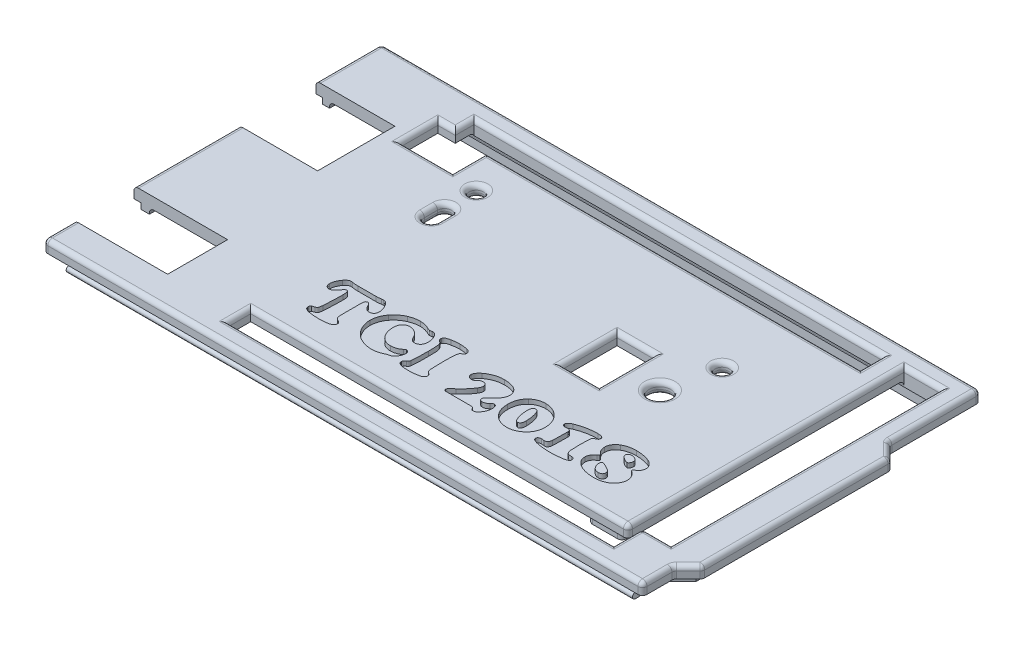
SolidWorks part; units mm, degrees
ref_plane "Front Plane" through (0, 0, 0) normal (0, 0, 1) x (1, 0, 0)
ref_plane "Top Plane" through (0, 0, 0) normal (0, 1, 0) x (1, 0, 0)
ref_plane "Right Plane" through (0, 0, 0) normal (1, 0, 0) x (0, 0, -1)
sketch "Sketch1" plane through (0, 0, 0) normal (0, 1, 0) x (1, 0, 0)
  line L0 (-61.422, -13.8418) -> (43.538, -13.8418)
  line L4 (46.078, -65.0518) -> (43.538, -67.5918)
  line L5 (43.538, -67.5918) -> (43.538, -73.0818)
  line L6 (43.538, -73.0818) -> (-61.422, -73.0818)
  line L7 (-61.422, -73.0818) -> (-61.422, -13.8418)
  line L8 (43.538, -13.8418) -> (43.538, -29.7418)
  line L9 (43.538, -29.7418) -> (46.078, -32.2818)
  line L10 (46.078, -32.2818) -> (46.078, -65.0518)
extrude "Boss-Extrude1" add sketch "Sketch1" along normal blind 2
sketch "Sketch2" plane through (0, 2, 0) normal (0, 1, 0) x (1, 0, 0)
  line L0 (-61.422, -13.8418) -> (-61.422, -73.0818) construction
  line L1 (-61.422, -67.7018) -> (-45.022, -67.7018)
  line L2 (-61.422, -67.7018) -> (-61.422, -57.2018)
  line L3 (-61.422, -57.2018) -> (-45.022, -57.2018)
  line L4 (-45.022, -67.7018) -> (-45.022, -57.2018)
  line L5 (-61.422, -73.0818) -> (43.538, -73.0818) construction
  line L6 (-61.422, -25.3418) -> (-47.572, -25.3418)
  line L7 (-61.422, -25.3418) -> (-61.422, -38.8818)
  line L8 (-61.422, -38.8818) -> (-47.572, -38.8818)
  line L9 (-47.572, -25.3418) -> (-47.572, -38.8818)
  line L10 (43.538, -13.8418) -> (-61.422, -13.8418) construction
  line L11 (43.538, -29.7418) -> (43.538, -13.8418) construction
  line L12 (-32.552, -65.6318) -> (33.548, -65.6318)
  line L13 (-32.552, -65.6318) -> (-32.552, -69.5418)
  line L14 (-32.552, -69.5418) -> (34.988, -69.5418)
  line L15 (34.988, -65.6318) -> (34.988, -69.5418)
  line L16 (39.998, -64.5318) -> (34.988, -64.5318)
  line L17 (39.998, -64.5318) -> (39.998, -17.3118)
  line L18 (39.998, -17.3118) -> (33.548, -17.3118)
  line L19 (33.548, -64.5318) -> (33.548, -17.3118)
  line L20 (-31.902, -33.5618) -> (-31.902, -35.8518)
  line L21 (-41.692, -17.3818) -> (29.908, -17.3818)
  line L22 (-41.692, -17.3818) -> (-41.692, -20.6518)
  line L23 (-35.622, -21.2918) -> (29.908, -21.2918)
  line L24 (29.908, -17.3818) -> (29.908, -21.2918)
  line L25 (-44.742, -20.6518) -> (-41.692, -20.6518)
  line L26 (-44.742, -20.6518) -> (-44.742, -27.1518)
  line L27 (-44.742, -27.1518) -> (-35.622, -27.1518)
  line L28 (-35.622, -21.2918) -> (-35.622, -27.1518)
  line L29 (-29.452, -33.5618) -> (-29.452, -35.8518)
  line L30 (46.078, -65.0518) -> (46.078, -32.2818) construction
  line L31 (3.188, -37.1818) -> (9.688, -37.1818)
  line L32 (3.188, -37.1818) -> (3.188, -46.8018)
  line L33 (3.188, -46.8018) -> (9.688, -46.8018)
  line L34 (9.688, -37.1818) -> (9.688, -46.8018)
  line L35 (34.988, -65.6318) -> (34.988, -64.5318)
  line L36 (33.548, -64.5318) -> (33.548, -65.6318)
  circle A0 centre (-30.677, -27.9718) radius 1.225
  arc A1 (-29.452, -33.5618) -> (-31.902, -33.5618) centre (-30.677, -33.5618) ccw
  arc A2 (-31.902, -35.8518) -> (-29.452, -35.8518) centre (-30.677, -35.8518) ccw
  circle A3 centre (17.718, -33.3018) radius 1.225
  circle A4 centre (15.698, -42.1918) radius 1.875
  point P18 (-32.552, -67.5868)
  point P29 (29.908, -19.3368)
extrude "Cut-Extrude1" cut sketch "Sketch2" against normal blind 2
sketch "Sketch3" plane through (0, 0, 0) normal (0, -1, 0) x (1, 0, 0)
  line L0 (43.538, 13.8418) -> (-61.422, 13.8418) construction
  line L1 (-60.222, 15.0418) -> (42.338, 15.0418)
  line L2 (-60.222, 15.0418) -> (-60.222, 17.3818)
  line L3 (-59.022, 17.3118) -> (39.998, 17.3118)
  line L4 (42.338, 15.0418) -> (42.338, 18.3118)
  line L5 (43.538, 29.7418) -> (43.538, 13.8418) construction
  line L6 (-61.422, 13.8418) -> (-61.422, 25.3418) construction
  line L7 (-61.422, 38.8818) -> (-47.572, 38.8818) construction
  line L8 (-47.572, 25.3418) -> (-61.422, 25.3418) construction
  line L10 (-60.222, 17.3818) -> (-60.222, 25.3418)
  line L11 (-60.222, 25.3418) -> (-59.022, 25.3418)
  line L12 (-59.022, 17.3118) -> (-59.022, 25.3418)
  line L13 (-61.422, 73.0818) -> (43.538, 73.0818) construction
  line L14 (-60.222, 71.8818) -> (40.588, 71.8818)
  line L15 (-60.222, 71.8818) -> (-60.222, 69.5418)
  line L16 (-59.022, 69.5418) -> (40.1778, 69.5418)
  line L18 (-32.552, 69.5418) -> (34.988, 69.5418) construction
  line L19 (-61.422, 67.7018) -> (-61.422, 73.0818) construction
  line L20 (-58.7131, 38.8818) -> (-60.222, 38.8818)
  line L21 (-61.422, 67.7018) -> (-45.022, 67.7018) construction
  line L23 (-60.222, 69.5418) -> (-60.222, 67.7018)
  line L24 (-60.222, 67.7018) -> (-59.022, 67.7018)
  line L25 (-59.022, 69.5418) -> (-59.022, 67.7018)
  line L26 (39.998, 17.3118) -> (33.548, 17.3118) construction
  line L32 (-58.7131, 38.8818) -> (-58.7131, 57.2018)
  line L33 (-58.7131, 57.2018) -> (-60.222, 57.2018)
  line L34 (-60.222, 38.8818) -> (-60.222, 57.2018)
  line L35 (-45.022, 57.2018) -> (-61.422, 57.2018) construction
  line L37 (39.998, 17.3118) -> (39.998, 29.7418)
  line L39 (42.338, 18.3118) -> (42.338, 29.7418)
  line L43 (46.078, 65.0518) -> (46.078, 32.2818) construction
  line L45 (44.878, 32.2818) -> (44.878, 65.0518)
  line L47 (42.7178, 32.2818) -> (42.7178, 65.0518)
  line L50 (42.338, 29.7418) -> (44.878, 32.2818)
  line L52 (42.7178, 32.2818) -> (39.998, 29.7418)
  line L53 (40.588, 71.8818) -> (42.338, 71.8818)
  line L56 (42.338, 71.8818) -> (42.338, 67.5918)
  line L57 (43.538, 73.0818) -> (43.538, 67.5918) construction
  line L58 (44.878, 65.0518) -> (42.338, 67.5918)
  line L59 (42.7178, 65.0518) -> (40.1778, 67.5918)
  line L60 (40.1778, 67.5918) -> (40.1778, 69.5418)
  line L61 (-61.422, 38.8818) -> (-61.422, 57.2018) construction
  point P6 (42.338, 16.6768)
extrude "Boss-Extrude2" add sketch "Sketch3" along normal blind 1
fillet "Fillet31" radius 0.8 1 edges at (-61.422, 1, 73.0818)
fillet "Fillet33" radius 0.8 4 edges at (34.988, 2, 67.0368) (0.498, 2, 65.6318) (-32.552, 2, 67.5868) (1.218, 2, 69.5418)
fillet "Fillet35" radius 0.8 8 edges at (34.988, 0.6, 64.5318) (35.2223, 1.7657, 64.5318) (33.548, 0.6, 65.6318) (33.548, 1.7657, 65.3975) (36.773, 2, 17.3118) (39.998, 2, 40.9218) (37.893, 2, 64.5318) (33.548, 2, 41.0718)
fillet "Fillet37" radius 0.8 8 edges at (-43.217, 2, 20.6518) (-40.182, 2, 27.1518) (-35.622, 2, 24.2218) (-41.692, 2, 19.0168) (29.908, 2, 19.3368) (-5.892, 2, 17.3818) (-2.857, 2, 21.2918) (-44.742, 2, 23.9018)
fillet "Fillet38" radius 0.8 4 edges at (-30.677, 2, 32.3368) (-31.902, 2, 34.7068) (-30.677, 2, 37.0768) (-29.452, 2, 34.7068)
fillet "Fillet39" radius 0.8 1 edges at (-30.677, 2, 29.1968)
fillet "Fillet40" radius 0.8 6 edges at (6.438, 2, 37.1818) (3.188, 2, 41.9918) (9.688, 2, 41.9918) (6.438, 2, 46.8018) (15.698, 2, 44.0668) (17.718, 2, 34.5268)
sketch "Sketch6" plane through (0, 0, 0) normal (0, -1, 0) x (1, 0, 0)
  line L0 (46.078, 65.0518) -> (46.078, 32.2818) construction
  line L1 (21.048, 60.1318) -> (26.998, 60.1318)
  line L2 (21.048, 60.1318) -> (21.048, 56.2518)
  line L3 (21.048, 56.2518) -> (26.998, 56.2518)
  line L4 (26.998, 60.1318) -> (26.998, 56.2518)
  line L5 (-60.622, 73.0818) -> (43.538, 73.0818) construction
  line L6 (-61.422, 38.8818) -> (-61.422, 57.2018) construction
  line L7 (-20.332, 46.7518) -> (-26.282, 46.7518)
  line L8 (-20.332, 46.7518) -> (-20.332, 42.8718)
  line L9 (-20.332, 42.8718) -> (-26.282, 42.8718)
  line L10 (-26.282, 46.7518) -> (-26.282, 42.8718)
  point P12 (-26.282, 44.8118)
  point P15 (-20.332, 44.8118)
extrude "Boss-Extrude5" add sketch "Sketch6" along normal blind 6.3
fillet "Fillet44" radius 0.8 8 edges at (24.023, 0, 60.1318) (26.998, 0, 58.1918) (24.023, 0, 56.2518) (21.048, 0, 58.1918) (-23.307, 0, 46.7518) (-26.282, 0, 44.8118) (-20.332, 0, 44.8118) (-23.307, 0, 42.8718)
fillet "Fillet45" radius 0.8 16 edges at (-20.0977, -0.2343, 42.6375) (-26.5163, -0.2343, 42.6375) (-26.5163, -0.2343, 46.9861) (-20.0977, -0.2343, 46.9861) (20.8137, -0.2343, 56.0175) (20.8137, -0.2343, 60.3661) (27.2323, -0.2343, 60.3661) (27.2323, -0.2343, 56.0175) (-20.332, -3.55, 42.8718) (-26.282, -3.55, 42.8718) (-26.282, -3.55, 46.7518) (-20.332, -3.55, 46.7518) (21.048, -3.55, 56.2518) (21.048, -3.55, 60.1318) (26.998, -3.55, 60.1318) (26.998, -3.55, 56.2518)
fillet "Fillet46" radius 0.8 7 edges at (43.538, 1, 67.5918) (46.078, 1, 65.0518) (46.078, 1, 32.2818) (43.538, 1, 29.7418) (-61.422, 1, 13.8418) (43.538, 1, 13.8418) (43.538, 1, 73.0818)
fillet "Fillet49" radius 0.8 18 edges at (-61.422, 2, 19.9918) (43.3037, 2, 72.8475) (43.5989, 2, 67.617) (46.0171, 2, 65.0265) (44.808, 2, 66.3218) (43.5989, 2, 29.7165) (44.808, 2, 31.0118) (46.0171, 2, 32.307) (43.3037, 2, 14.0761) (43.538, 2, 22.0261) (46.078, 2, 48.6668) (43.538, 2, 70.1025) (-8.942, 2, 13.8418) (-61.1877, 2, 14.0761) (-8.942, 2, 73.0818) (-61.1877, 2, 72.8475) (-61.422, 2, 69.9918) (-61.422, 2, 48.0418)
fillet "Fillet50" radius 0.8 7 edges at (17.718, 0, 34.5268) (15.698, 0, 44.0668) (-30.677, 0, 29.1968) (-30.677, 0, 32.3368) (-29.452, 0, 34.7068) (-30.677, 0, 37.0768) (-31.902, 0, 34.7068)
fillet "Fillet55" radius 0.8 10 edges at (-59.022, 0, 68.6218) (-45.787, 0, 69.5418) (-58.7131, 0, 48.0418) (-59.022, 0, 21.3268) (-12.737, 0, 17.3118) (37.5829, 0, 69.5418) (40.1778, 0, 68.5668) (41.4478, 0, 66.3218) (42.7178, 0, 48.6668) (41.3579, 0, 31.0118)
sketch "Sketch12" plane through (0, -1, 0) normal (0, -1, 0) x (1, 0, 0)
  line L0 (-58.9966, 17.3372) -> (-58.9966, 25.3418) construction
  line L1 (-59.022, 70.1818) -> (40.1754, 70.1818)
  line L2 (-59.022, 70.1818) -> (-59.022, 70.9818)
  line L3 (-59.022, 70.9818) -> (40.1754, 70.9818)
  line L4 (40.1754, 70.1818) -> (40.1754, 70.9818)
  line L5 (39.998, 16.7418) -> (-59.022, 16.7418)
  line L6 (39.998, 16.7418) -> (39.998, 15.9418)
  line L7 (39.998, 15.9418) -> (-59.022, 15.9418)
  line L8 (-59.022, 16.7418) -> (-59.022, 15.9418)
  line L9 (39.998, 29.7418) -> (39.998, 17.3118) construction
  line L10 (40.1524, 69.5164) -> (40.1524, 67.5812) construction
  line L11 (-58.9966, 67.7018) -> (-58.9966, 67.9672) construction
  line L12 (-60.622, 73.0818) -> (42.738, 73.0818) construction
  line L13 (42.738, 13.8418) -> (-60.622, 13.8418) construction
extrude "Boss-Extrude6" add sketch "Sketch12" along normal blind 2
sketch "Sketch13" plane through (0, 0, 70.9818) normal (0, 0, 1) x (1, 0, 0)
  line L0 (-59.022, -3) -> (-59.022, -1) construction
  line L1 (-59.022, -2.5) -> (40.1754, -2.5)
  line L2 (-59.022, -2.5) -> (-59.022, -2)
  line L3 (-59.022, -2) -> (40.1754, -2)
  line L4 (40.1754, -2.5) -> (40.1754, -2)
  line L5 (40.1754, -3) -> (40.1754, -1) construction
  line L6 (40.1754, -3) -> (-59.022, -3) construction
revolve "Revolve3" add sketch "Sketch13" angle 180 about L1
sketch "Sketch14" plane through (0, 0, 15.9418) normal (0, 0, -1) x (-1, 0, 0)
  line L0 (-39.998, -3) -> (-39.998, -1) construction
  line L1 (-39.998, -2.5) -> (59.022, -2.5)
  line L2 (-39.998, -2.5) -> (-39.998, -2)
  line L3 (-39.998, -2) -> (59.022, -2)
  line L4 (59.022, -2.5) -> (59.022, -2)
  line L5 (59.022, -3) -> (59.022, -1) construction
  line L6 (59.022, -3) -> (-39.998, -3) construction
revolve "Revolve4" add sketch "Sketch14" angle 180 about L1
sketch "Sketch15" plane through (0, 2, 0) normal (0, 1, 0) x (1, 0, 0)
  text T0 "TCI 2018  " font "Cooper Black" height in points 36
extrude "Cut-Extrude2" cut sketch "Sketch15" against normal blind 0.8
fillet "Fillet56" radius 0.5 2 edges at (-9.512, -1, 16.7418) (-9.4233, -1, 70.1818)
equation "\"Margen_seguridad\"= 1.5'Margen de seguridad para asegurarnos que quepa perfectamente el arduino"
equation "\"Grosor_punta\"= 0.4'Grosor de la punta de la impresora 3D"
equation "\"Grosor_caja\"= 2'Grosor que queremos tener en la caja"
equation "\"Grosor_cierre\"= 1'Grosor de la raja que tienen las paredes laterales para el cierre"
equation "\"Anchura_cierre\"= 2'Anchura que hay desde la parte de arriba del lateral hasta la mueca para el cierre"
equation "\"Profundidad_cierre\"= 0.8'Profundidad de la mueca para el cierre de la tapa"
equation "\"Grosor_borde\"= 1.2'Grosor de la tapadera de arriba para que no se pueda mover hacia los lados y encaje"
equation "\"Anchura_borde\"= 1.2'Anchura que hay desde el filo de la tapadera al cierre"
equation "\"Altura_soporte\"= 6.3'Altura que hay desde la tapa de arriba para que no se pueda mover hacia los lados y encaje"
equation "\"Curvatura_cierre\"= 0.8'Radio de curvatura de las esquinas para que queden redondeadas"
equation "\"D1@Sketch1\"=53.34+2*\"Grosor_caja\"+\"Margen_seguridad\"+\"Grosor_punta\""
equation "\"D2@Sketch1\"=99.06+2*\"Grosor_caja\"+\"Margen_seguridad\"+\"Grosor_punta\""
equation "\"D3@Sketch1\"=2.54+\"Grosor_caja\"+\"Margen_seguridad\"/2+\"Grosor_punta\"/2"
equation "\"D4@Sketch1\"=2.54"
equation "\"D5@Sketch1\"=2.54"
equation "\"D6@Sketch1\"=12.95+\"Grosor_caja\"+\"Margen_seguridad\"/2+\"Grosor_punta\"/2"
equation "\"D7@Sketch1\"=2.54"
equation "\"D8@Sketch1\"=2.54"
equation "\"D1@Boss-Extrude1\"=\"Grosor_caja\""
equation "\"D1@Sketch2\"=3.18+\"Grosor_caja\"+\"Grosor_punta\"/2"
equation "\"D2@Sketch2\"=9+\"Margen_seguridad\""
equation "\"D3@Sketch2\"=12.7+\"Grosor_caja\"+\"Margen_seguridad\"+\"Grosor_punta\"/2"
equation "\"D4@Sketch2\"=9.3+\"Grosor_caja\"+\"Grosor_punta\"/2"
equation "\"D5@Sketch2\"=12.04+\"Margen_seguridad\""
equation "\"D6@Sketch2\"=10.15+\"Grosor_caja\"+\"Grosor_punta\"/2+\"Margen_seguridad\""
equation "\"D7@Sketch2\"=66.04+\"Margen_seguridad\""
equation "\"D8@Sketch2\"=26.67+\"Grosor_caja\"+\"Grosor_punta\"/2"
equation "\"D9@Sketch2\"=2.41+\"Margen_seguridad\""
equation "\"D10@Sketch2\"=1.34+\"Grosor_caja\"+\"Grosor_punta\"/2"
equation "\"D11@Sketch2\"=1.34+\"Grosor_caja\"+\"Grosor_punta\"/2"
equation "\"D12@Sketch2\"=4.95+\"Margen_seguridad\""
equation "\"D13@Sketch2\"=1.27+\"Grosor_caja\"+\"Grosor_punta\"/2"
equation "\"D14@Sketch2\"=45.72+\"Margen_seguridad\""
equation "\"D15@Sketch2\"=1.34+\"Grosor_caja\"+\"Grosor_punta\"/2"
equation "\"D16@Sketch2\"=2.41+\"Margen_seguridad\""
equation "\"D17@Sketch2\"=70.1+\"Margen_seguridad\""
equation "\"D18@Sketch2\"=17.53+\"Grosor_caja\"+\"Grosor_punta\"/2"
equation "\"D19@Sketch2\"=14.48+\"Grosor_caja\"+\"Grosor_punta\"/2"
equation "\"D20@Sketch2\"=4.61+\"Grosor_caja\"+\"Grosor_punta\"/2"
equation "\"D21@Sketch2\"=5+\"Margen_seguridad\""
equation "\"D22@Sketch2\"=7.62+\"Margen_seguridad\""
equation "\"D23@Sketch2\"=11.18+\"Grosor_caja\"+\"Grosor_punta\"/2+\"Margen_seguridad\"/2"
equation "\"D26@Sketch2\"=1.7+\"Margen_seguridad\"/2"
equation "\"D27@Sketch2\"=1.7+\"Margen_seguridad\"/2"
equation "\"D28@Sketch2\"=1.7+\"Margen_seguridad\"/2"
equation "\"D29@Sketch2\"=24.08+\"Grosor_caja\"+\"Grosor_punta\"/2"
equation "\"D30@Sketch2\"=8.12+\"Margen_seguridad\""
equation "\"D31@Sketch2\"=5+\"Margen_seguridad\""
equation "\"D32@Sketch2\"=34.19+\"Grosor_caja\"+\"Grosor_punta\"/2"
equation "\"D33@Sketch2\"=16.51+\"Grosor_caja\"+\"Margen_seguridad\"/2+\"Grosor_punta\"/2"
equation "\"D34@Sketch2\"=22.87+\"Grosor_caja\"+\"Margen_seguridad\"/2+\"Grosor_punta\"/2"
equation "\"D35@Sketch2\"=1.7+\"Margen_seguridad\"/2"
equation "\"D36@Sketch2\"=27.43+\"Grosor_caja\"+\"Margen_seguridad\"/2+\"Grosor_punta\"/2"
equation "\"D37@Sketch2\"=25.4+\"Grosor_caja\"+\"Margen_seguridad\"/2+\"Grosor_punta\"/2"
equation "\"D38@Sketch2\"=3+\"Margen_seguridad\"/2"
equation "\"D1@Cut-Extrude1\"=\"Grosor_caja\""
equation "\"D1@Sketch3\"=\"Grosor_caja\"/2+\"Grosor_punta\"/2"
equation "\"D2@Sketch3\"=\"Grosor_caja\"/2+\"Grosor_punta\"/2"
equation "\"D3@Sketch3\"=\"D2@Sketch3\""
equation "\"D5@Sketch3\" = \"Grosor_caja\" / 2 + \"Grosor_punta\" / 2"
equation "\"D6@Sketch3\"=\"Grosor_caja\"/2+\"Grosor_punta\"/2"
equation "\"D8@Sketch3\"=\"D3@Sketch3\""
equation "\"D10@Sketch3\"= \"Grosor_caja\" / 2 + \"Grosor_punta\" / 2"
equation "\"D1@Boss-Extrude2\"=\"Anchura_cierre\" / 2"
equation "\"D1@Fillet31\"=\"Curvatura_cierre\""
equation "\"D1@Fillet33\"=\"Curvatura_cierre\""
equation "\"D1@Fillet35\"=\"Curvatura_cierre\""
equation "\"D1@Fillet38\"=\"Curvatura_cierre\""
equation "\"D1@Fillet39\"=\"Curvatura_cierre\""
equation "\"D1@Fillet37\"=\"Curvatura_cierre\""
equation "\"D1@Fillet40\"=\"Curvatura_cierre\""
equation "\"D1@Sketch6\"=16.13+\"Grosor_caja\"+\"Grosor_punta\"/2+\"Margen_seguridad\"/2"
equation "\"D4@Sketch6\"=3.88"
equation "\"D5@Sketch6\"=32.19+\"Grosor_caja\"+\"Margen_seguridad\"/2+\"Grosor_punta\"/2"
equation "\"D6@Sketch6\"=\"D3@Sketch6\""
equation "\"D1@Boss-Extrude5\"=\"Altura_soporte\""
equation "\"D1@Fillet44\"=\"Curvatura_cierre\""
equation "\"D1@Fillet45\"=\"Curvatura_cierre\""
equation "\"D1@Fillet46\"=\"Curvatura_cierre\""
equation "\"D1@Fillet49\"=\"Curvatura_cierre\""
equation "\"D1@Fillet50\"=\"Curvatura_cierre\""
equation "\"D4@Sketch3\"=\"Grosor_caja\"/2+\"Grosor_punta\"/2"
equation "\"D7@Sketch3\"=\"Grosor_caja\"/2+\"Grosor_punta\"/2"
equation "\"D9@Sketch3\"=\"D3@Sketch3\""
equation "\"D1@Boss-Extrude6\"=\"Anchura_cierre\"/2+\"Grosor_cierre\""
equation "\"D1@Fillet55\"=\"Curvatura_cierre\""
equation "\"D1@Sketch12\"=\"Grosor_caja\"+0.1"
equation "\"Anchura_pared\"= 0.8'Anchura que tiene la pared para poner el cierre"
equation "\"D3@Sketch12\"=\"Grosor_caja\"+0.1"
equation "\"D4@Sketch12\"= \"Anchura_pared\""
equation "\"D2@Sketch12\"=\"D4@Sketch12\""
equation "\"D1@Sketch13\"=\"Grosor_cierre\"/2"
equation "\"D2@Sketch13\"=\"Grosor_cierre\"/2"
equation "\"D1@Sketch14\"=\"Grosor_cierre\"/2"
equation "\"D2@Sketch14\"=\"Grosor_cierre\"/2"
equation "\"D1@Cut-Extrude2\"=\"Grosor_caja\"/2-0.2"
equation "\"D1@Fillet56\"=0.5"
equation "\"D2@Sketch12\"=\"Anchura_pared\""
equation "\"D1@Fillet3\"=\"Curvatura_cierre\""
equation "\"D1@Fillet10\"=\"Curvatura_cierre\""
equation "\"D1@Fillet13\"=\"Curvatura_cierre\""
equation "\"D1@Fillet16\"=\"Curvatura_cierre\""
equation "\"D1@Fillet29\"=\"Curvatura_cierre\""
equation "\"D1@Fillet12\"=\"Curvatura_cierre\""
